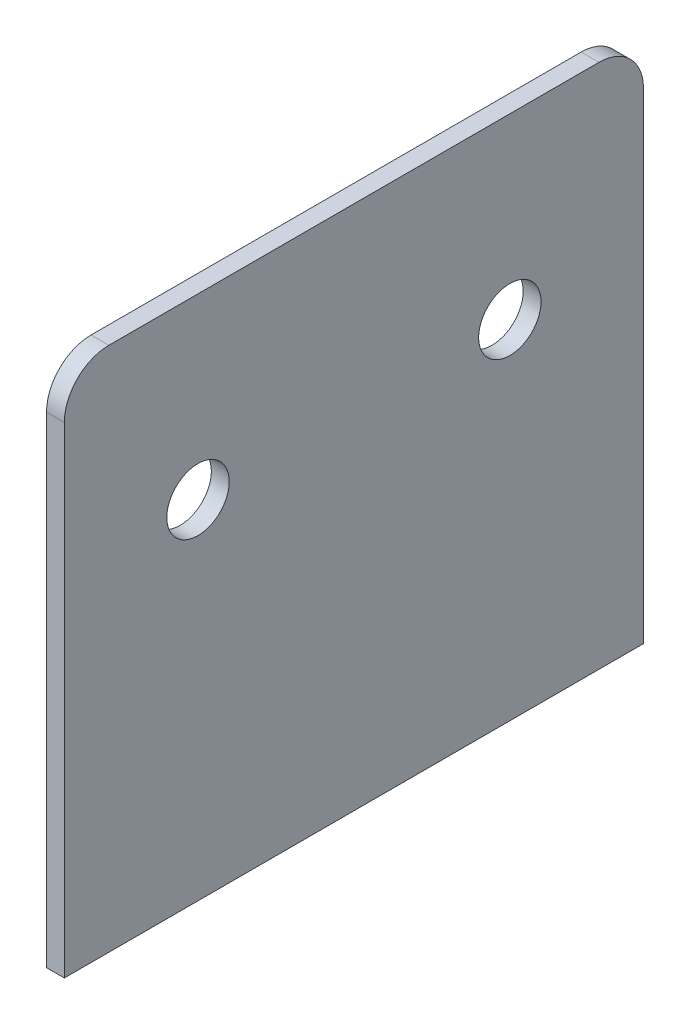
SolidWorks part; units mm, degrees
ref_plane "Plan de face" through (0, 0, 0) normal (0, 0, 1) x (1, 0, 0)
ref_plane "Plan de dessus" through (0, 0, 0) normal (0, 1, 0) x (1, 0, 0)
ref_plane "Plan de droite" through (0, 0, 0) normal (1, 0, 0) x (0, 0, -1)
sketch "Esquisse1" plane through (0, 0, 0) normal (0, 0, 1) x (1, 0, 0)
  line L0 (0, 0) -> (0, 59)
  dimension "D1" = 59
sheet metal parameters "Tôlerie 1" thickness 2 parameters "D1"=2.6
base flange "Tôle de base pliée1" sketch "Esquisse1" end condition mid plane depth 65 reverse direction no thickness 2 reverse thickness direction no bend radius 2.6
sketch "Esquisse4" plane through (2, 0, 0) normal (1, 0, 0) x (0, 0, -1)
  line L1 (-32.5, 0) -> (32.5, 0) construction
  line L2 (-32.5, 59) -> (32.5, 59) construction
  circle A0 centre (-17.5, 39) radius 3.5
  circle A1 centre (17.5, 39) radius 3.5
  point P4 (0, 0)
  dimension "D1" = 17.5
  dimension "D4" = 7
  dimension "D2" = 35
  dimension "D3" = 20
extrude "Enlèv. mat.-Extru.1" cut sketch "Esquisse4" against normal blind 10
fillet "Congé1" radius 5 2 edges at (1, 59, -32.5) (1, 59, 32.5)
flat pattern "Etat déplié1"
sketch "Lignes de pliage1" plane through (0, 0, 0) normal (0, 1, 0) x (1, 0, 0)
sketch3d "Cube de visualisation1" [suppressed]
  line L0 (-65, 59, 0) -> (0, 59, 0) construction
  line L1 (-65, 0, 0) -> (0, 0, 0) construction
  line L2 (-65, 59, 0) -> (-65, 0, 0) construction
  line L3 (0, 59, 0) -> (0, 0, 0) construction
